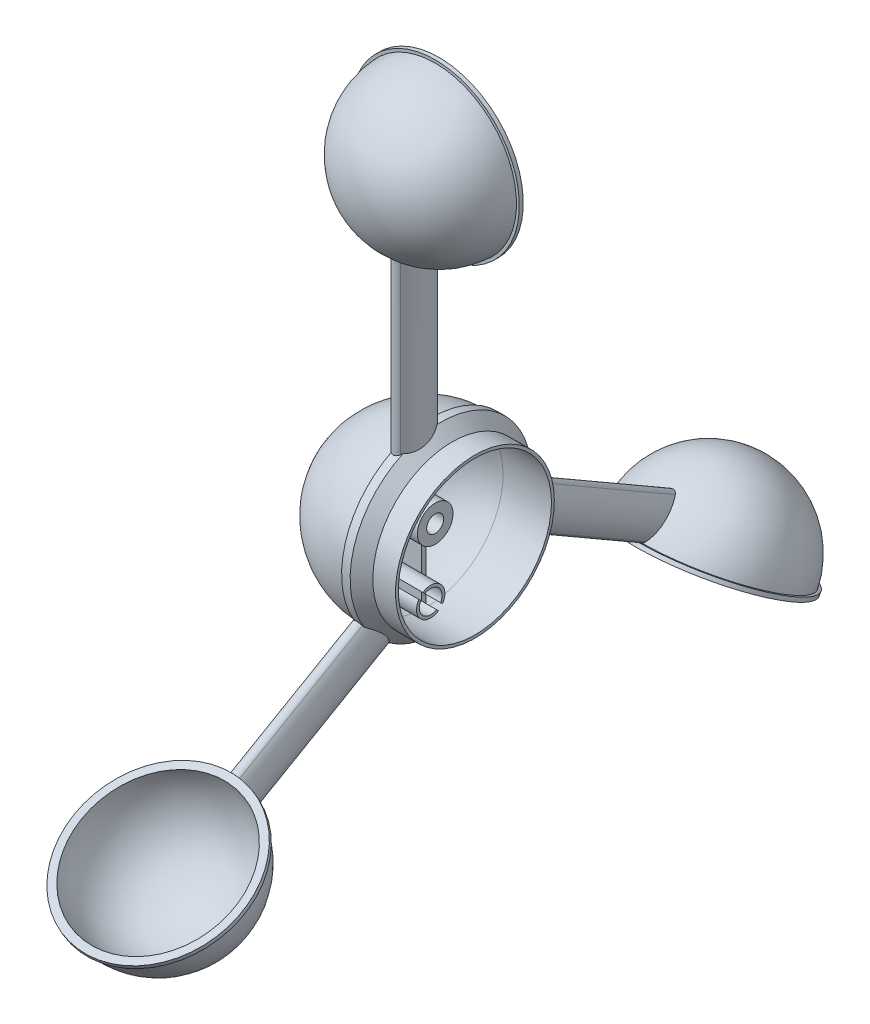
SolidWorks part; units mm, degrees
ref_plane "Plan de face" through (0, 0, 0) normal (0, 0, 1) x (1, 0, 0)
ref_plane "Plan de dessus" through (0, 0, 0) normal (0, 1, 0) x (1, 0, 0)
ref_plane "Plan de droite" through (0, 0, 0) normal (1, 0, 0) x (0, 0, -1)
sketch "Esquisse1" plane through (0, 0, 0) normal (0, 0, 1) x (1, 0, 0)
  line L0 (0, 0) -> (-70.0685, 0) construction
  line L1 (0, 13.5) -> (0, 14)
  line L2 (0, 14) -> (-4, 14)
  line L3 (-4, 14) -> (-6, 16)
  line L4 (-6, 16) -> (-7.5, 16)
  line L5 (-7.5, 16) -> (-7.5, 15.5)
  line L6 (0, 13.5) -> (-8.5256, 13.5)
  line L7 (-24.7335, 0) -> (-22.7015, 0)
  arc A0 (-22.339, 8.0512) -> (-24.7335, 0) centre (-10, 0) ccw
  arc A1 (-7.5, 15.5) -> (-22.339, 8.0512) centre (-8.5256, -0.9621) ccw
  arc A2 (-8.5256, 13.5) -> (-20.6373, 6.9409) centre (-8.5256, -0.9621) ccw
  arc A3 (-20.6373, 6.9409) -> (-22.7015, 0) centre (-10, 0) ccw
  dimension "D8" = 0.5
  dimension "D1" = 4
  dimension "D2" = 135
  dimension "D3" = 1.5
  dimension "D5" = 10
  dimension "D9" = 0.5
revolve "moyeu" add sketch "Esquisse1" angle 360 about L0
sketch "Esquisse6" plane through (0, 0, 0) normal (1, 0, 0) x (0, 0, -1)
  line L0 (0, 0) -> (-7.7942, -4.5) construction
  line L1 (0, 0) -> (0, 10.7887) construction
  circle A0 centre (-7.7942, -4.5) radius 2.5
  circle A1 centre (-7.7942, -4.5) radius 2
  dimension "D1" = 5
  dimension "D2" = 4
  dimension "D3" = 9
  dimension "D4" = 120
extrude "logement aimant" add sketch "Esquisse6" against normal up to next
sketch "Esquisse7" plane through (0, 0, 0) normal (1, 0, 0) x (0, 0, -1)
  line L0 (0, 0) -> (-6.1471, -6.1471) construction
  line L1 (-10.0362, -2.9651) -> (-5.7936, -7.2078)
  line L2 (-10.0362, -2.9651) -> (-9.3291, -2.258)
  line L3 (-9.3291, -2.258) -> (-5.0865, -6.5007)
  line L4 (-5.7936, -7.2078) -> (-5.0865, -6.5007)
  line L5 (-6.1471, -6.1471) -> (-10.5829, -1.7114) construction
  dimension "D1" = 1
  dimension "D2" = 0.5
  dimension "D3" = 5
  dimension "D4" = 6
extrude "rainure" cut sketch "Esquisse7" against normal blind 10
ref_plane "Plan1" through (-7, 0, 0) normal (1, 0, 0) x (0, 0, -1)
ref_plane "Plan2" through (0, 13.5, 0) normal (0, 1, 0) x (-1, 0, 0)
sketch "Esquisse8" plane through (-7, 0, 0) normal (1, 0, 0) x (0, 0, -1)
  circle A0 centre (0, 0) radius 3.15
  dimension "D1" = 6.3
extrude "moyeu d'axe" add sketch "Esquisse8" against normal up to next
ref_plane "Plan3" through (-9, 0, 0) normal (1, 0, 0) x (0, 0, -1)
sketch "Esquisse10" plane through (-9, 0, 0) normal (1, 0, 0) x (0, 0, -1)
  line L0 (-1.4872, 1.7768) -> (-7.2285, 11.7209)
  line L1 (-7.2285, 11.7209) -> (-6.5356, 12.1209)
  line L2 (-6.5356, 12.1209) -> (-0.8129, 2.2088)
  line L4 (0, 0) -> (0, 12.6286) construction
  line L5 (-1.4872, 1.7768) -> (-0.8129, 2.2088)
  dimension "D2" = 0.8
  dimension "D3" = 30
extrude "nervure" add sketch "Esquisse10" against normal up to surface (11.9233 mm away)
pattern_circular "Répétition nervure" count 2 over 150 about axis through (-500000, 0, 0) along (1, 0, 0) of "nervure"
sketch "Esquisse2" plane through (0, 13.5, 0) normal (0, 1, 0) x (-1, 0, 0)
  line L0 (0, 0) -> (19.105, 0) construction
  line L2 (7, 17.6) -> (7, -17.6) construction
  arc A0 (7.8392, 6.9438) -> (6.1776, 6.969) centre (7, 6.4) ccw
  arc A2 (7.8392, 6.9438) -> (8.7811, 3.6841) centre (2.9203, 3.7565) cw
  arc A3 (7.8392, 0.4244) -> (8.7811, 3.6841) centre (2.9203, 3.6116) ccw
  arc A4 (7.8392, 0.4244) -> (6.1776, 0.3992) centre (7, 0.9682) cw
  arc A5 (6.1776, 0.3992) -> (6.1776, 6.969) centre (10.9256, 3.6841) cw
  dimension "D1" = 6.4
  dimension "D2" = 2
extrude "bras" add sketch "Esquisse2" along normal blind 33
sketch "Esquisse5" plane through (-7, 0, 0) normal (1, 0, 0) x (0, 0, -1)
  circle A0 centre (0, 56) radius 13.9
  dimension "D1" = 27.8
  dimension "D2" = 56
extrude "logement de la coupelle" cut sketch "Esquisse5" against normal mid plane 10
pattern_circular "Répétition des bras" count 3 over 360 about axis through (0, 0, 0) along (1, 0, 0) of "bras", "logement de la coupelle"
sketch "Esquisse3" plane through (-7, 0, 0) normal (1, 0, 0) x (0, 0, -1)
  line L0 (0, 0) -> (0, 81.8938) construction
  line L1 (0, 70.327) -> (0, 70.8271)
  line L2 (0, 70.8271) -> (0.7, 70.8277)
  line L3 (-12.8, 56) -> (-13.6441, 56)
  line L4 (0.7, 70.8277) -> (0.7, 69.5)
  arc A0 (0.7, 69.5) -> (-12.8, 56) centre (0.7, 56) ccw
  arc A1 (0, 70.327) -> (-13.6441, 56) centre (0.7, 56) ccw
  dimension "D1" = 27
  dimension "D2" = 56
  dimension "D4" = 0.7
revolve "coupelle" add sketch "Esquisse3" angle 360 about L3
pattern_circular "Répétition des coupelles" count 3 over 360 about axis through (0, 0, 0) along (1, 0, 0) of "coupelle"
sketch "Esquisse9" plane through (-7, 0, 0) normal (1, 0, 0) x (0, 0, -1)
  circle A0 centre (0, 0) radius 1.5
  dimension "D1" = 3
extrude "axe 3" cut sketch "Esquisse9" against normal blind 15
ref_plane "Plan4" through (-17, 0, 0) normal (1, 0, 0) x (0, 0, -1)
sketch "Esquisse12" plane through (-17, 0, 0) normal (1, 0, 0) x (0, 0, -1)
  line L0 (0, 0) -> (15.2496, 8.8044) construction
  line L1 (0.2693, 3.0423) -> (6.1566, 6.4413)
  line L2 (7.4066, 4.2762) -> (6.1566, 6.4413)
  line L3 (-35.9325, -21.2066) -> (-13.6525, -8.3432) construction
  line L5 (7.4066, 4.2762) -> (1.5193, 0.8772)
  line L6 (1.5193, 0.8772) -> (0.2693, 3.0423)
  dimension "D1" = 2.5
revolve "matière pour vis" add sketch "Esquisse12" angle 360 about L0
sketch "Esquisse13" plane through (0, 4.2762, -7.4066) normal (0, 0.5, -0.866) x (-1, 0, 0)
  circle A0 centre (17, 0) radius 3.75
  dimension "D1" = 7.5
extrude "matière1 pour vis" add sketch "Esquisse13" along normal up to next
sketch "Esquisse14" plane through (-17, 0, 0) normal (1, 0, 0) x (0, 0, -1)
  line L0 (0, 0) -> (15.95, 9.2088) construction
  line L1 (0, 0) -> (-0.75, 1.299)
  line L2 (-0.75, 1.299) -> (7.9103, 6.299)
  line L3 (7.9103, 6.299) -> (7.1603, 7.5981)
  line L4 (7.1603, 7.5981) -> (14.286, 11.7121)
  line L5 (14.286, 11.7121) -> (15.786, 9.1141)
  line L6 (15.786, 9.1141) -> (0, 0)
  line L7 (0, 0) -> (15.2496, 8.8044) construction
  dimension "D1" = 1.5
  dimension "D2" = 3
  dimension "D3" = 10
revolve "vis de fixation" cut sketch "Esquisse14" angle 360 about L6
sketch "Esquisse15" plane through (0, 0, 0) normal (1, 0, 0) x (0, 0, -1)
  line L0 (-7.7942, -4.5) -> (0, 0) construction
  circle A0 centre (-3.6373, -2.1) radius 0.75
  dimension "D1" = 1.5
  dimension "D2" = 4.2
extrude "percage trou d'eau" cut sketch "Esquisse15" against normal blind 40
pattern_circular "Répétition circulaire1" count 3 over 360 about axis through (0, 0, 0) along (1, 0, 0) of "percage trou d'eau"
